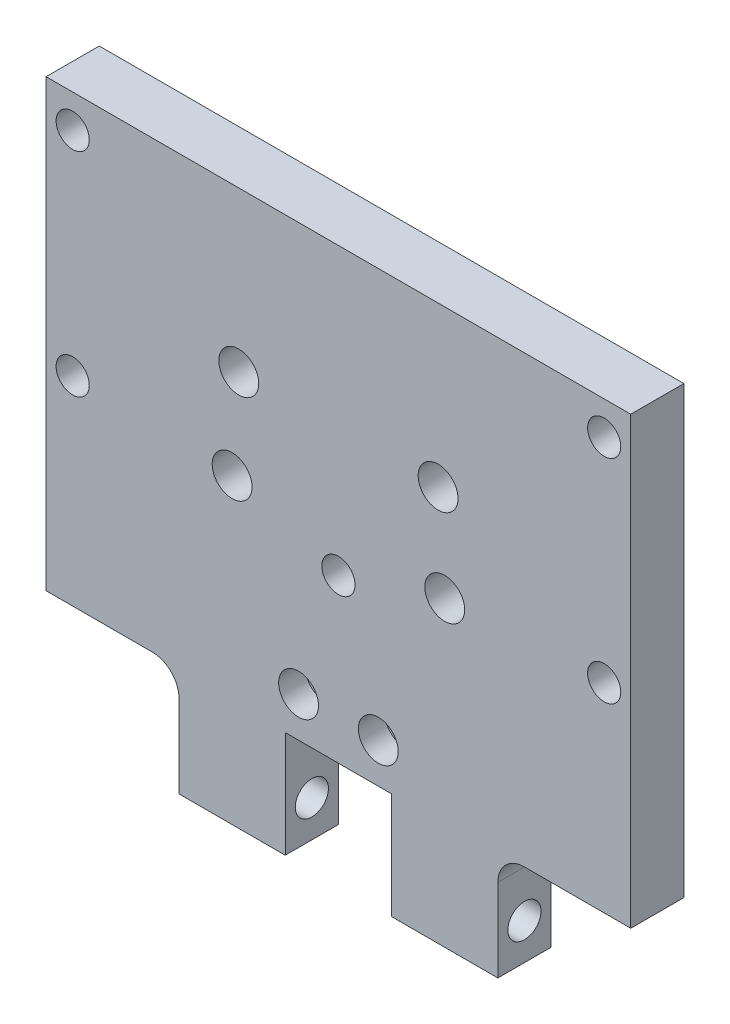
SolidWorks part; units mm, degrees
ref_plane "Front Plane" through (0, 0, 0) normal (0, 0, 1) x (1, 0, 0)
ref_plane "Top Plane" through (0, 0, 0) normal (0, 1, 0) x (1, 0, 0)
ref_plane "Right Plane" through (0, 0, 0) normal (1, 0, 0) x (0, 0, -1)
sketch "Sketch1" plane through (0, 0, 0) normal (0, 0, 1) x (1, 0, 0)
  line L0 (0, 0) -> (0, 36.9311) construction
  line L1 (-69.85, -94.4372) -> (-12.7, -94.4372)
  line L2 (69.85, -94.4372) -> (69.85, 38.1)
  line L3 (69.85, 38.1) -> (-69.85, 38.1)
  line L4 (-69.85, 38.1) -> (-69.85, -94.4372)
  line L5 (0, 0) -> (-15.1945, 0) construction
  line L10 (12.7, -94.4372) -> (12.7, -69.0372)
  line L11 (12.7, -69.0372) -> (-12.7, -69.0372)
  line L12 (-12.7, -69.0372) -> (-12.7, -94.4372)
  line L13 (12.7, -94.4372) -> (69.85, -94.4372)
  line L14 (-12.7, -85.725) -> (0, -85.725) construction
  line L15 (0, -85.725) -> (12.7, -85.725) construction
  line L16 (-38.1, -94.4372) -> (-38.1, -68.2752)
  line L17 (-38.1, -68.2752) -> (-69.85, -68.2752)
  line L18 (38.1, -94.4372) -> (38.1, -68.2752)
  line L19 (38.1, -68.2752) -> (69.85, -68.2752)
  circle A0 centre (23.8125, 0) radius 4.7625
  circle A1 centre (-23.8125, 0) radius 4.7625
  circle A2 centre (-63.5, 30.1752) radius 3.9624
  circle A3 centre (-63.5, -20.6248) radius 3.9624
  circle A4 centre (63.5, 30.1752) radius 3.9624
  circle A5 centre (63.5, -20.6248) radius 3.9624
  circle A6 centre (-63.5, 30.1752) radius 6
  circle A7 centre (-63.5, -20.6248) radius 6
  circle A8 centre (63.5, -20.6248) radius 6
  circle A9 centre (63.5, 30.1752) radius 6
  circle A10 centre (25.4, -22.225) radius 4.7625
  circle A11 centre (-25.4, -22.225) radius 4.7625
  circle A12 centre (0, -30.1752) radius 3.9624
  circle A13 centre (-9.525, -59.5122) radius 3.175
  circle A14 centre (9.525, -59.5122) radius 3.175
  circle A15 centre (-9.525, -59.5122) radius 4.7625
  circle A16 centre (9.525, -59.5122) radius 4.7625
  dimension "D2" = 9.525
  dimension "D9" = 7.9248
  dimension "D13" = 12
  dimension "D17" = 9.525
  dimension "D21" = 7.9248
  dimension "D23" = 6.35
  dimension "D26" = 9.525
  dimension "D1" = 47.625
  dimension "D3" = 25.4
  dimension "D4" = 25.4
  dimension "D5" = 123.825
  dimension "D6" = 38.1
  dimension "D7" = 132.5372
  dimension "D8" = 139.7
  dimension "D10" = 63.5
  dimension "D11" = 50.8
  dimension "D12" = 7.9248
  dimension "D14" = 25.4
  dimension "D15" = 106.3752
  dimension "D16" = 50.8
  dimension "D18" = 60.325
  dimension "D19" = 68.2752
  dimension "D20" = 7.9502
  dimension "D22" = 34.925
  dimension "D24" = 19.05
  dimension "D25" = 9.525
sketch "Sketch2" plane through (0, 0, 0) normal (0, 0, 1) x (1, 0, 0)
  line L0 (-38.1, -94.4372) -> (-38.1, -68.2752) construction
  line L1 (69.85, -94.4372) -> (69.85, 38.1) construction
  line L2 (69.85, 38.1) -> (-69.85, 38.1) construction
  line L3 (-69.85, 38.1) -> (-69.85, -94.4372) construction
  line L4 (-38.1, -68.2752) -> (-69.85, -68.2752) construction
  line L5 (38.1, -94.4372) -> (38.1, -68.2752) construction
  line L6 (38.1, -68.2752) -> (69.85, -68.2752) construction
  line L7 (-38.1, -94.4372) -> (-38.1, -68.2752)
  line L8 (12.7, -94.4372) -> (69.85, -94.4372) construction
  line L9 (69.85, -68.2752) -> (69.85, 38.1)
  line L10 (69.85, 38.1) -> (-69.85, 38.1)
  line L11 (-69.85, 38.1) -> (-69.85, -68.2752)
  line L12 (12.7, -94.4372) -> (12.7, -69.0372) construction
  line L13 (12.7, -69.0372) -> (-12.7, -69.0372) construction
  line L14 (-12.7, -69.0372) -> (-12.7, -94.4372) construction
  line L15 (-69.85, -94.4372) -> (-12.7, -94.4372) construction
  line L16 (12.7, -94.4372) -> (38.1, -94.4372)
  line L17 (12.7, -94.4372) -> (12.7, -69.0372)
  line L18 (12.7, -69.0372) -> (-12.7, -69.0372)
  line L19 (-12.7, -69.0372) -> (-12.7, -94.4372)
  line L20 (-38.1, -94.4372) -> (-12.7, -94.4372)
  line L21 (-38.1, -68.2752) -> (-69.85, -68.2752)
  line L22 (38.1, -94.4372) -> (38.1, -68.2752)
  line L23 (38.1, -68.2752) -> (69.85, -68.2752)
  circle A0 centre (-23.8125, 0) radius 4.7625 construction
  circle A1 centre (23.8125, 0) radius 4.7625 construction
  circle A2 centre (-23.8125, 0) radius 4.7625
  circle A3 centre (23.8125, 0) radius 4.7625
  circle A4 centre (-63.5, -20.6248) radius 3.9624 construction
  circle A5 centre (-63.5, 30.1752) radius 3.9624 construction
  circle A6 centre (63.5, -20.6248) radius 3.9624 construction
  circle A7 centre (63.5, 30.1752) radius 3.9624 construction
  circle A8 centre (-63.5, -20.6248) radius 3.9624
  circle A9 centre (-63.5, 30.1752) radius 3.9624
  circle A10 centre (63.5, -20.6248) radius 3.9624
  circle A11 centre (63.5, 30.1752) radius 3.9624
  circle A12 centre (-25.4, -22.225) radius 4.7625 construction
  circle A13 centre (25.4, -22.225) radius 4.7625 construction
  circle A14 centre (-25.4, -22.225) radius 4.7625
  circle A15 centre (25.4, -22.225) radius 4.7625
  circle A16 centre (0, -30.1752) radius 3.9624 construction
  circle A17 centre (0, -30.1752) radius 3.9624
  circle A18 centre (-9.525, -59.5122) radius 3.175 construction
  circle A19 centre (9.525, -59.5122) radius 3.175 construction
  circle A20 centre (-9.525, -59.5122) radius 3.175
  circle A21 centre (9.525, -59.5122) radius 3.175
extrude "Boss-Extrude1" add sketch "Sketch2" against normal mid plane 12.7
sketch "Sketch3" plane through (0, 0, 0) normal (1, 0, 0) x (0, 0, -1)
  circle A0 centre (0, -85.725) radius 3.9624
  dimension "D1" = 7.9248
extrude "Cut-Extrude1" cut sketch "Sketch3" against normal mid plane 203.2
sketch "Sketch4" plane through (0, 0, 0) normal (0, 0, 1) x (1, 0, 0)
  circle A0 centre (-63.5, -20.6248) radius 6 construction
  circle A1 centre (-63.5, 30.1752) radius 6 construction
  circle A2 centre (63.5, -20.6248) radius 6 construction
  circle A3 centre (63.5, 30.1752) radius 6 construction
  circle A4 centre (-63.5, -20.6248) radius 6
  circle A5 centre (-63.5, 30.1752) radius 6
  circle A6 centre (63.5, -20.6248) radius 6
  circle A7 centre (63.5, 30.1752) radius 6
extrude "Cut-Extrude2" [suppressed] cut sketch "Sketch4" against normal blind 8.89
fillet "Fillet1" radius 6.35 2 edges at (38.1, -68.2752, 0) (-38.1, -68.2752, 0)
sketch "Sketch5" plane through (0, 0, 0) normal (0, 0, 1) x (1, 0, 0)
  circle A0 centre (-9.525, -59.5122) radius 4.7625 construction
  circle A1 centre (9.525, -59.5122) radius 4.7625 construction
  circle A2 centre (-9.525, -59.5122) radius 4.7625
  circle A3 centre (9.525, -59.5122) radius 4.7625
extrude "Cut-Extrude3" cut sketch "Sketch5" along normal blind 7.62
